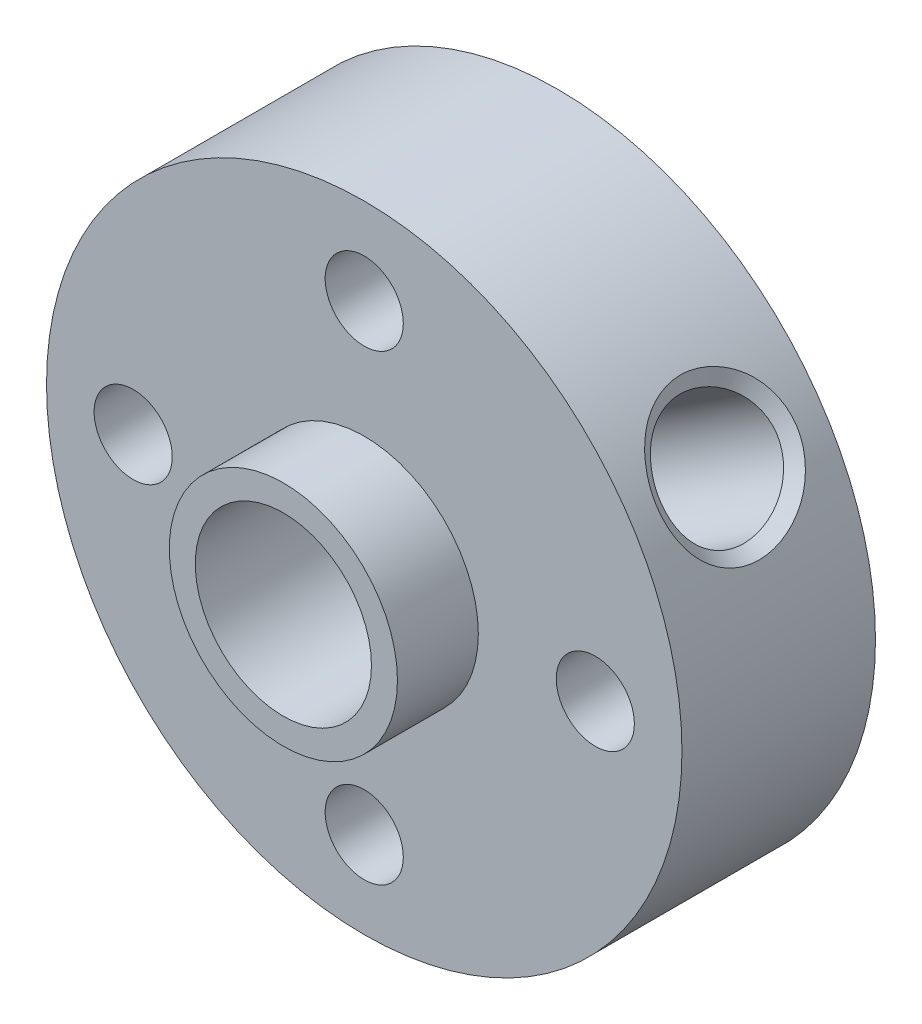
SolidWorks part; units mm, degrees
ref_plane "Front Plane" through (0, 0, 0) normal (0, 0, 1) x (1, 0, 0)
ref_plane "Top Plane" through (0, 0, 0) normal (0, 1, 0) x (1, 0, 0)
ref_plane "Right Plane" through (0, 0, 0) normal (1, 0, 0) x (0, 0, -1)
sketch "Sketch1" plane through (0, 0, 0) normal (0, 0, 1) x (1, 0, 0)
  circle A0 centre (0, 0) radius 11
  dimension "D1" = 22
extrude "Extrude1" add sketch "Sketch1" against normal blind 6.7
sketch "Sketch2" plane through (0, 0, 0) normal (0, 0, 1) x (1, 0, 0)
  circle A0 centre (0, 0) radius 3.95
  dimension "D1" = 7.9
extrude "Extrude2" add sketch "Sketch2" along normal blind 2.8
sketch "Sketch3" plane through (0, 0, 2.8) normal (0, 0, 1) x (1, 0, 0)
  circle A0 centre (0, 0) radius 3.05
  dimension "D1" = 6.1
extrude "Cut-Extrude1" cut sketch "Sketch3" against normal through all
hole_wizard "#10-32 Tapped Hole2" positions "3DSketch3" profile "Sketch6" tap size "#10-32" standard "Ansi Inch"
sketch3d "3DSketch3"
  point P0 (9.2231, 5.9946, -3.3269)
sketch "Sketch6" plane through (9.2231, 5.9946, -3.3269) normal (0, 0, 1) x (-0.545, 0.8385, 0)
  line L0 (0, 0) -> (0, 14.8233)
  line L1 (0, 14.8233) -> (2.0193, 13.61)
  line L2 (2.0193, 13.61) -> (2.0193, 0)
  line L5 (2.0193, 0) -> (0, 0)
  line L10 (0, 14.8233) -> (-2.0193, 13.61) construction
  line L11 (0, -6.35) -> (0, 107.95) construction
  dimension "Tap Drill Dia." = 4.0386
  dimension "Tap Drill Depth" = 13.61
  dimension "Drill Angle" = 118
hole_wizard "#6-32 Tapped Hole3" positions "3DSketch4" profile "Sketch7" tap size "#6-32" standard "Ansi Inch"
sketch3d "3DSketch4"
  line L0 (0, 0, 0) -> (13.2813, 0, 0) construction
  line L1 (13.2813, 0, 0) -> (-13.4508, 0, 0) construction
  line L3 (0, 0, 0) -> (0, -11.5868, 0) construction
  line L4 (0, -11.5868, 0) -> (0, 11.7986, 0) construction
  point P0 (0, 8, 0)
  point P2 (-8, 0, 0)
  point P4 (8, 0, 0)
  point P6 (0, -8, 0)
  dimension "D1" = 8
  dimension "D2" = 8
  dimension "D3" = 8
  dimension "D4" = 8
sketch "Sketch7" plane through (0, 8, 0) normal (1, 0, 0) x (0, -1, 0)
  line L0 (0, 0) -> (0, 6.7)
  line L1 (0, 6.7) -> (1.3525, 6.7)
  line L2 (1.3525, 6.7) -> (1.3525, 0)
  line L5 (1.3525, 0) -> (0, 0)
  line L11 (0, -6.35) -> (0, 107.95) construction
  dimension "Thru Tap Drill Dia." = 2.7051
  dimension "Thru Tap Drill Depth" = 6.7
chamfer "Chamfer2" distance 0.5 angle 45 1 edges at (10.149, 4.2425, -3.7535)
